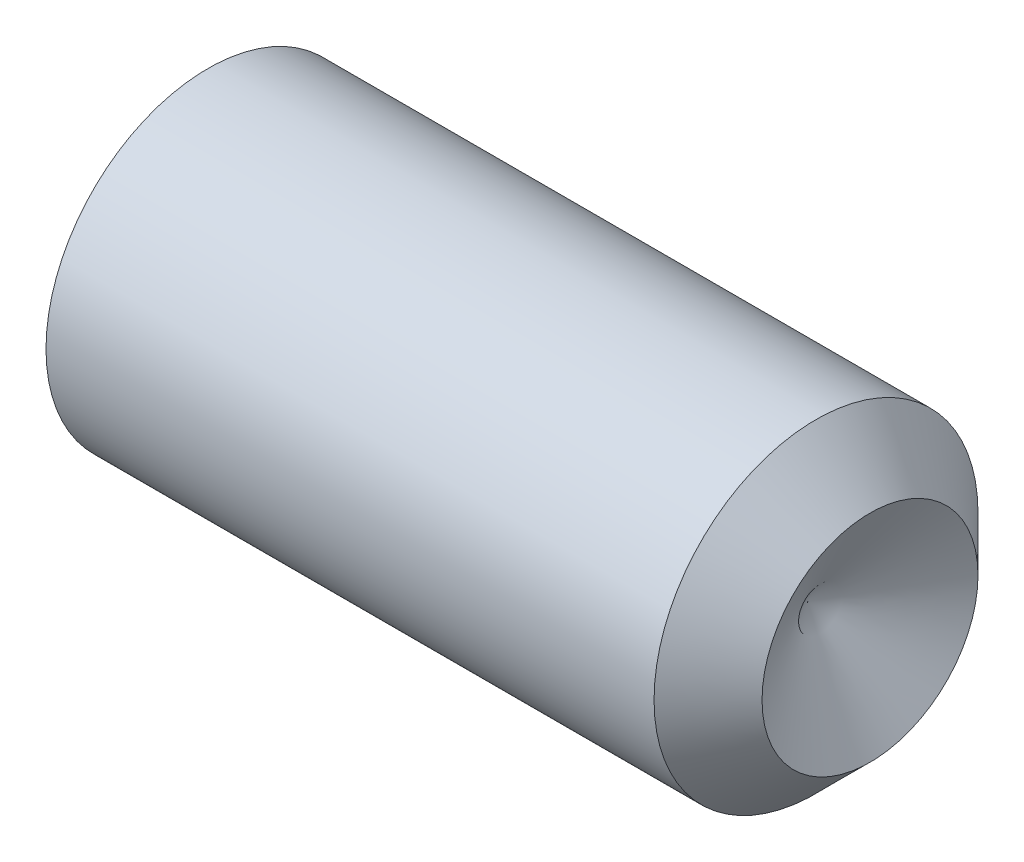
SolidWorks part; units mm, degrees
ref_plane "Plane1" through (0, 0, 0) normal (0, 0, 1) x (1, 0, 0)
ref_plane "Plane2" through (0, 0, 0) normal (0, 1, 0) x (1, 0, 0)
ref_plane "Plane3" through (0, 0, 0) normal (1, 0, 0) x (0, 0, -1)
sketch "BodySke" plane through (0, 0, 0) normal (0, 0, 1) x (1, 0, 0)
  line L0 (0, 0) -> (0, 10.352)
  line L1 (0, 10.352) -> (0.9515, 12)
  line L2 (0.9515, 12) -> (46, 12)
  line L3 (46, 12) -> (50, 8)
  line L4 (45.3812, 0) -> (0, 0)
  line L5 (-12.7, 0) -> (88.9, 0) construction
  line L6 (45.3812, 0) -> (50, 8)
  line L7 (50, 8) -> (50, 17.525) construction
  line L8 (0, -10.352) -> (0.9515, -12) construction
  line L9 (45.3812, 0) -> (50, -8) construction
  line L10 (46, -12) -> (50, -8) construction
  line L11 (1.5, 15.875) -> (1.5, -3.175) construction
  dimension "Length" = 50
  dimension "Diameter" = 24
  dimension "Drive_ch_ang" = 60
  dimension "Minor_dia" = 20.704
  dimension "Cup_nose_ang" = 45
  dimension "Cup_ang" = 120
  dimension "Cup_dia" = 16
  dimension "Advance" = 3
revolve "BaseBody" add sketch "BodySke" angle 360 about L5
sketch "Sketch2" plane through (0, 0, 0) normal (-1, 0, 0) x (0, 0, 1)
  line L0 (3.4641, 6) -> (-3.4641, 6)
  line L1 (-3.4641, 6) -> (-6.9282, 0)
  line L2 (3.4641, 6) -> (6.9282, 0)
  line L3 (3.4641, -6) -> (6.9282, 0)
  line L4 (3.4641, -6) -> (-3.4641, -6)
  line L5 (-3.4641, -6) -> (-6.9282, 0)
  dimension "Hex_size" = 12
  dimension "D2" = 6
  dimension "D3" = 6
extrude "Hex" cut sketch "Sketch2" against normal blind 15
sketch "ThdSchSke" plane through (0, 0, 0) normal (0, 0, 1) x (1, 0, 0)
  line L0 (0.9515, -10.352) -> (-0.2025, -12)
  line L1 (0.9515, -10.352) -> (2.1054, -12)
  line L2 (2.1054, -12) -> (2.1054, -15)
  line L3 (-3.175, 0) -> (5.1513, 0) construction
  line L4 (0.9515, 12) -> (0.9515, -12) construction
  line L5 (2.1054, -15) -> (-0.2025, -15)
  line L6 (-0.2025, -15) -> (-0.2025, -12)
  dimension "Thread_minor" = 20.704
  dimension "Diameter" = 24
  dimension "SideAngle" = 55
  dimension "VeeAngle" = 70
  dimension "Overcut" = 30
revolve "ThreadSchematic" [suppressed] cut sketch "ThdSchSke" angle 360 about L3
pattern_linear "ThdSchPat" [suppressed]
equation "\"D2@Sketch2\" = \"Hex_size@Sketch2\" / 2"
equation "\"D3@Sketch2\" = \"Hex_size@Sketch2\" / 2"
equation "\"Thread_minor@ThreadCosmetic\" = \"Minor_dia@BodySke\""
equation "\"Thread_minor@ThdSchSke\" = \"Thread_minor@ThreadCosmetic\""
equation "\"Diameter@ThdSchSke\" = \"Diameter@BodySke\""
equation "\"Overcut@ThdSchSke\" = \"Diameter@BodySke\" * 1.25"
equation "\"Num_threads@ThdSchPat\" = int( (\"Length@BodySke\" - ( ( ( \"Diameter@BodySke\" - \"Minor_dia@BodySke\" ) * 0.5 ) / tan( \"Drive_ch_ang@BodySke\" * 0.017453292 ) ) - ( ( ( \"Diameter@BodySke\" - \"Cup_dia@BodySk"
equation "\"Advance@ThdSchPat\" = (\"Length@BodySke\" - ( ( ( \"Diameter@BodySke\" - \"Minor_dia@BodySke\" ) * 0.5 ) / tan( \"Drive_ch_ang@BodySke\" * 0.017453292 ) ) - ( ( ( \"Diameter@BodySke\" - \"Cup_dia@BodySke\" ) * 0."
equation "' \"Num_threads@ThdSchPat\" = \"Num_threads@ThdSchPat\" - sgn( \"Num_threads@ThdSchPat\" - 1) '---chamfered tips only---"
